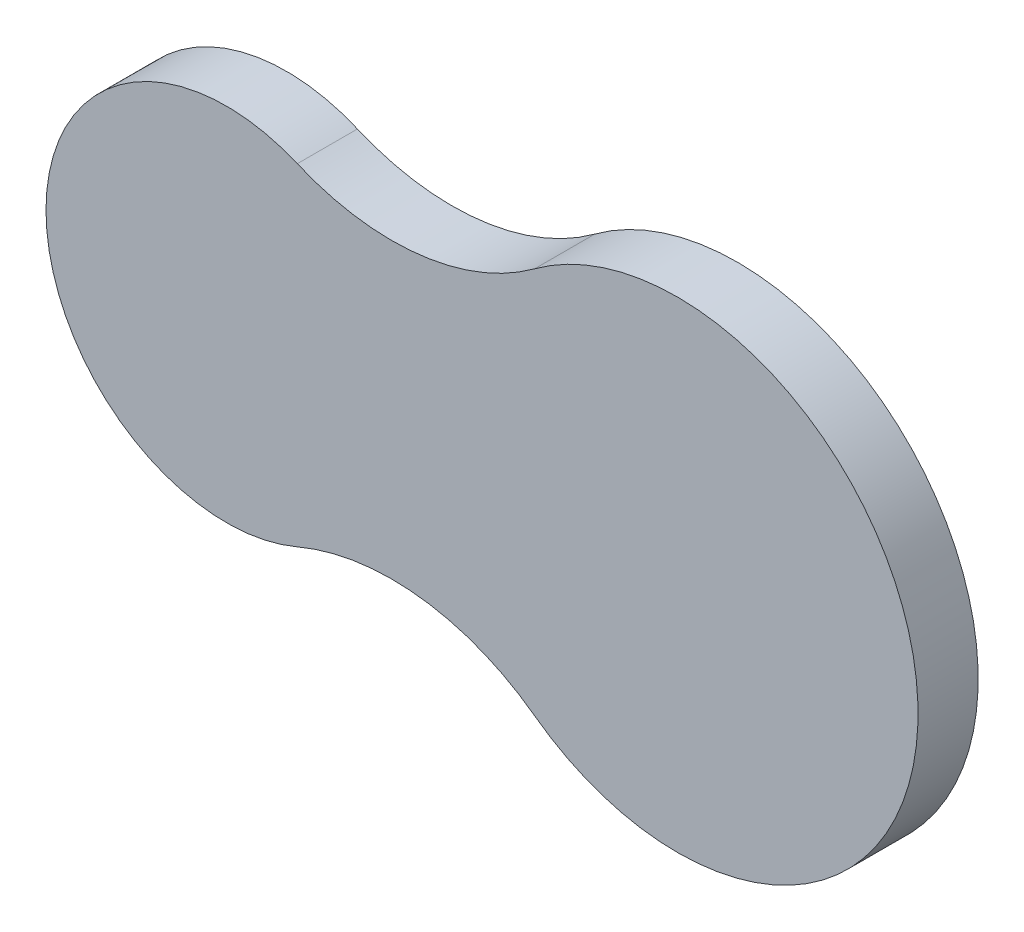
SolidWorks part; units mm, degrees
ref_plane "Front" through (0, 0, 0) normal (0, 0, 1) x (1, 0, 0)
ref_plane "Top" through (0, 0, 0) normal (0, 1, 0) x (1, 0, 0)
ref_plane "Right" through (0, 0, 0) normal (1, 0, 0) x (0, 0, -1)
sketch "Sketch1" plane through (0, 0, 0) normal (0, 0, 1) x (1, 0, 0)
  arc A0 (11.7857, 27.588) -> (11.7857, -27.588) centre (0, 0) ccw
  arc A1 (11.7857, 27.588) -> (51.25, 32.186) centre (27.5, 64.372) ccw
  arc A2 (51.25, 32.186) -> (51.25, -32.186) centre (75, 0) cw
  arc A3 (51.25, -32.186) -> (11.7857, -27.588) centre (27.5, -64.372) ccw
  dimension "D1" = 30
  dimension "D3" = 40
  dimension "D4" = 40
  dimension "D5" = 40
  dimension "D2" = 75
extrude "Extrude1" add sketch "Sketch1" along normal blind 10
